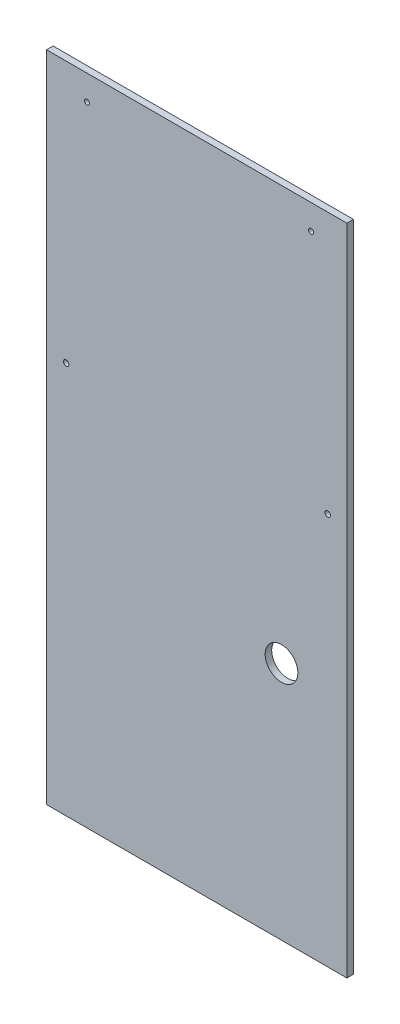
SolidWorks part; units mm, degrees
ref_plane "Front Plane" through (0, 0, 0) normal (0, 0, 1) x (1, 0, 0)
ref_plane "Top Plane" through (0, 0, 0) normal (0, 1, 0) x (1, 0, 0)
ref_plane "Right Plane" through (0, 0, 0) normal (1, 0, 0) x (0, 0, -1)
sketch "Sketch1" plane through (0, 0, 0) normal (0, 0, 1) x (1, 0, 0)
  line L1 (-175.006, -381) -> (175.006, -381)
  line L2 (-175.006, -381) -> (-175.006, 381)
  line L3 (-175.006, 381) -> (175.006, 381)
  line L4 (175.006, -381) -> (175.006, 381)
  line L5 (-175.006, -381) -> (175.006, 381) construction
  line L6 (-175.006, 381) -> (175.006, -381) construction
  point P0 (0, 0)
  dimension "D1" = 762
  dimension "D2" = 350.012
extrude "Boss-Extrude1" add sketch "Sketch1" along normal blind 7.62
sketch "Sketch2" plane through (0, 0, 7.62) normal (0, 0, 1) x (1, 0, 0)
  line L1 (175.006, 381) -> (-175.006, 381) construction
  line L2 (-175.006, 381) -> (-175.006, -381) construction
  line L3 (175.006, -381) -> (175.006, 381) construction
  circle A0 centre (-128.016, 351.79) radius 2.921
  circle A1 centre (133.35, 351.79) radius 2.921
  dimension "D1" = 5.842
  dimension "D2" = 29.21
  dimension "D3" = 46.99
  dimension "D4" = 5.842
  dimension "D5" = 41.656
  dimension "D6" = 29.21
extrude "Cut-Extrude1" cut sketch "Sketch2" against normal blind 7.62
sketch "Sketch3" plane through (0, 0, 7.62) normal (0, 0, 1) x (1, 0, 0)
  line L0 (175.006, -381) -> (175.006, 381) construction
  circle A0 centre (98.806, -101.6) radius 19.05
  dimension "D1" = 38.1
  dimension "D3" = 76.2
  dimension "D2" = 101.6
extrude "Cut-Extrude2" cut sketch "Sketch3" against normal through all
sketch "Sketch6" plane through (0, 0, 7.62) normal (0, 0, 1) x (1, 0, 0)
  line L0 (-175.006, 381) -> (-175.006, -381) construction
  circle A0 centre (152.6087, 76.2) radius 3.175
  circle A1 centre (-152.146, 76.2) radius 3.175
  dimension "D1" = 6.35
  dimension "D2" = 6.35
  dimension "D3" = 22.86
  dimension "D4" = 76.2
extrude "Cut-Extrude4" cut sketch "Sketch6" against normal through all
